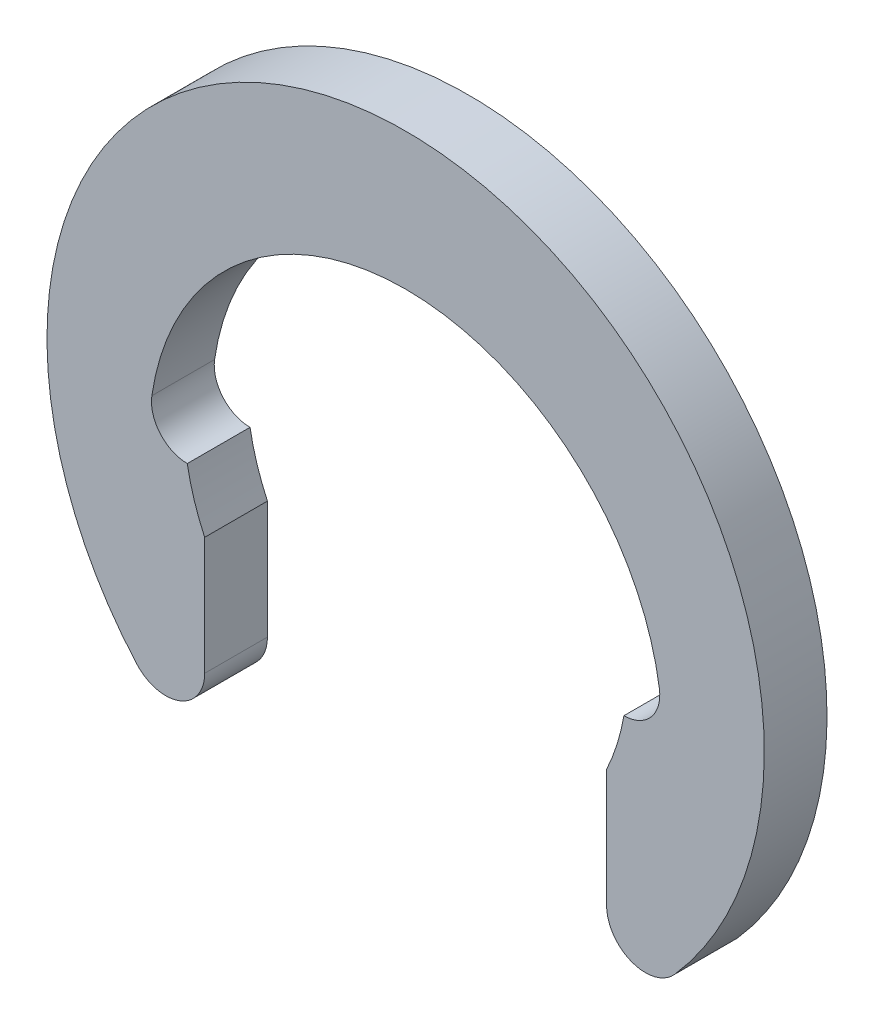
SolidWorks part; units mm, degrees
ref_plane "Plane1" through (0, 0, 0) normal (0, 0, 1) x (1, 0, 0)
ref_plane "Plane2" through (0, 0, 0) normal (0, 1, 0) x (1, 0, 0)
ref_plane "Plane3" through (0, 0, 0) normal (1, 0, 0) x (0, 0, -1)
sketch "Clipboard" plane through (0, 0, 0) normal (0, 0, 1) x (1, 0, 0)
  line L0 (0, 0) -> (0.7874, 0)
  circle A0 centre (0, 0) radius 1.2954
  circle A1 centre (0, 0) radius 2.0955
  dimension "FreeID" = 2.5908
  dimension "FreeOD" = 4.191
  dimension "LargeSection" = 0.7874
sketch "BodySke" plane through (0, 0, 0) normal (0, 0, 1) x (1, 0, 0)
  line L0 (-1.5431, 0) -> (1.5431, 0) construction
  line L1 (0, 0) -> (0, 1.3462) construction
  line L2 (0, 0) -> (1.3257, -0.2338) construction
  line L3 (0, 0) -> (1.2201, -0.5689) construction
  line L4 (0, 0) -> (-1.3257, -0.2338) construction
  line L5 (0, 0) -> (-1.2201, -0.5689) construction
  line L6 (1.2201, -0.5689) -> (1.2201, -1.2839)
  line L7 (-1.2201, -0.5689) -> (-1.2201, -1.2839)
  circle A0 centre (0, 0) radius 1.3462 construction
  arc A1 (1.5431, 0) -> (-1.5431, 0) centre (0, -0.2112) ccw construction
  arc A2 (1.6335, -1.4401) -> (-1.6335, -1.4401) centre (0, 0) ccw
  arc A3 (1.2201, -0.5689) -> (1.3257, -0.2338) centre (0, 0) ccw
  arc A4 (1.5409, 0.0153) -> (-1.5409, 0.0153) centre (0, -0.2112) ccw
  arc A5 (-1.3257, -0.2338) -> (-1.2201, -0.5689) centre (0, 0) ccw
  arc A6 (1.3257, -0.2338) -> (1.5409, 0.0153) centre (1.3257, -0.0163) ccw
  arc A7 (-1.5409, 0.0153) -> (-1.3257, -0.2338) centre (-1.3257, -0.0163) ccw
  arc A8 (1.2201, -1.2839) -> (1.6335, -1.4401) centre (1.4563, -1.2839) ccw
  arc A9 (-1.6335, -1.4401) -> (-1.2201, -1.2839) centre (-1.4563, -1.2839) ccw
  dimension "D1" = 10
  dimension "GrooveDia" = 2.6924
  dimension "OutsideDia" = 4.3554
  dimension "TipRad" = 0.2362
  dimension "CavityWidth" = 3.0861
  dimension "D2" = 15
extrude "Body" add sketch "BodySke" against normal blind 0.381
equation "' \"FreeID@Clipboard\" = 0.102"
equation "' \"Thickness@Body\" = 0.015"
equation "' \"GrooveDia@BodySke\" = 0.106"
equation "' \"FreeOD@Clipboard\" = 0.165"
equation "' \"LargeSection@Clipboard\" = 0.031"
equation "\"OutsideDia@BodySke\" = ( \"GrooveDia@BodySke\"  /  \"FreeID@Clipboard\" )  * \"FreeOD@Clipboard\""
equation "\"CavityWidth@BodySke\" = \"GrooveDia@BodySke\" + 0.25 * 2 * \"LargeSection@Clipboard\""
equation "\"TipRad@BodySke\" = 0.3 * \"LargeSection@Clipboard\""
